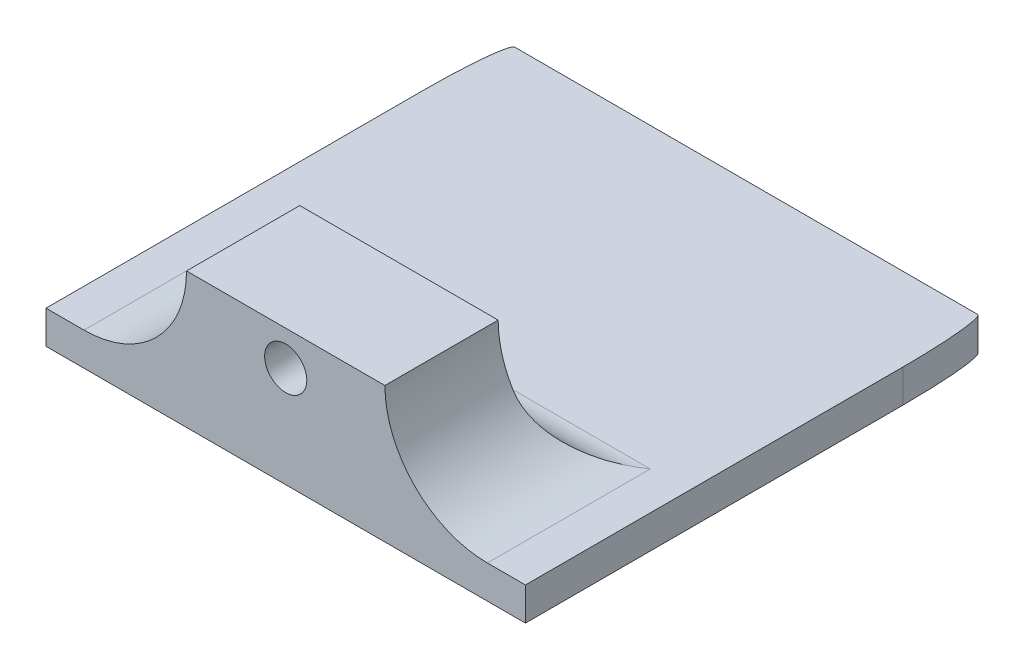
SolidWorks part; units mm, degrees
ref_plane "Front Plane" through (0, 0, 0) normal (0, 0, 1) x (1, 0, 0)
ref_plane "Top Plane" through (0, 0, 0) normal (0, 1, 0) x (1, 0, 0)
ref_plane "Right Plane" through (0, 0, 0) normal (1, 0, 0) x (0, 0, -1)
sketch "Sketch2" plane through (0, 0, 0) normal (0, 0, 1) x (1, 0, 0)
  line L1 (-29, -12.2) -> (29, -12.2)
  line L2 (-29, -12.2) -> (-29, 4.2)
  line L3 (-29, 4.2) -> (29, 4.2)
  line L4 (29, -12.2) -> (29, 4.2)
  circle A0 centre (0, 0) radius 2.55
  point P7 (0, 4.2)
  dimension "D1" = 5.1
  dimension "D2" = 4.2
  dimension "D3" = 58
  dimension "D4" = 12.2
extrude "Boss-Extrude1" add sketch "Sketch2" against normal blind 12.2
sketch "Sketch3" plane through (0, 0, -12.2) normal (0, 0, -1) x (-1, 0, 0)
  line L1 (-29, -12.2) -> (29, -12.2)
  line L2 (-29, -12.2) -> (-29, 4.2)
  line L3 (-29, 4.2) -> (29, 4.2)
  line L4 (29, -12.2) -> (29, 4.2)
extrude "Boss-Extrude2" add sketch "Sketch3" along normal blind 1.5
sketch "Sketch4" plane through (0, 0, -13.7) normal (0, 0, -1) x (-1, 0, 0)
  line L0 (29, -12.2) -> (29, 4.2) construction
  line L1 (-29, -12.2) -> (29, -12.2)
  line L2 (-29, -12.2) -> (-29, -8.2)
  line L3 (-29, -8.2) -> (29, -8.2)
  line L4 (29, -12.2) -> (29, -8.2)
  dimension "D1" = 4
extrude "Boss-Extrude3" add sketch "Sketch4" along normal blind 42
fillet "Fillet1" radius 10 1 edges at (29, -10.2, -55.7)
fillet "Fillet2" radius 10 1 edges at (-29, -10.2, -55.7)
fillet "Fillet3" radius 6 1 edges at (0, -8.2, -13.7)
sketch "Sketch5" plane through (0, 0, 0) normal (0, 0, 1) x (1, 0, 0)
  line L0 (0, 0) -> (0, 9.4705) construction
  line L8 (29, 4.2) -> (12, 4.2)
  line L11 (29, -12.2) -> (29, 4.2) construction
  line L12 (29, 4.2) -> (-29, 4.2) construction
  line L13 (12, -1.0562) -> (12, 7.9794) construction
  line L14 (24.4, -8.2) -> (29, -8.2)
  line L15 (29, -8.2) -> (29, 4.2)
  line L16 (-24.4, -8.2) -> (-29, -8.2)
  line L17 (-29, 4.2) -> (-12, 4.2)
  line L18 (-29, -8.2) -> (-29, 4.2)
  line L19 (-28, -8.2) -> (28, -8.2) construction
  arc A0 (12, 4.2) -> (24.4, -8.2) centre (24.4, 4.2) ccw
  arc A1 (-12, 4.2) -> (-24.4, -8.2) centre (-24.4, 4.2) cw
  point P20 (25.4995, -8.2)
  dimension "D1" = 17
extrude "Cut-Extrude1" cut sketch "Sketch5" against normal up to next
